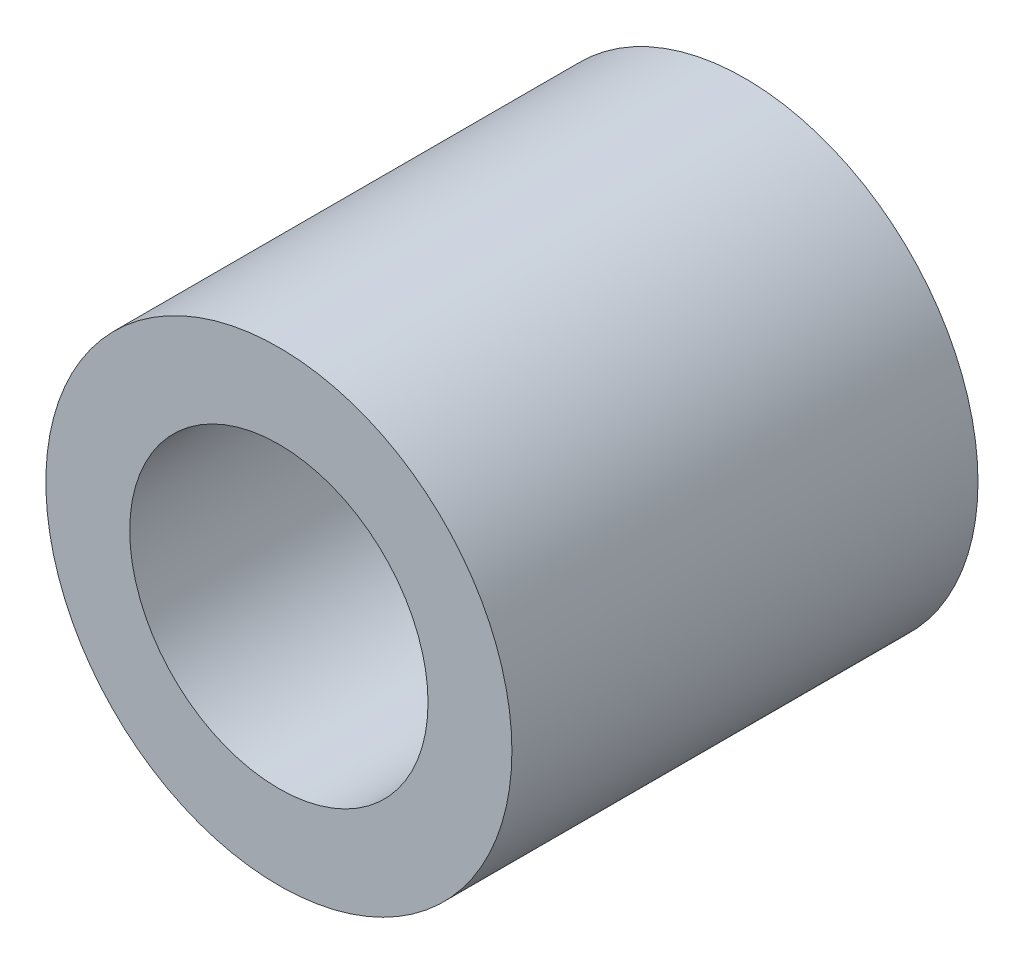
SolidWorks part; units mm, degrees
ref_plane "Alzado" through (0, 0, 0) normal (0, 0, 1) x (1, 0, 0)
ref_plane "Planta" through (0, 0, 0) normal (0, 1, 0) x (1, 0, 0)
ref_plane "Vista lateral" through (0, 0, 0) normal (1, 0, 0) x (0, 0, -1)
sketch "Croquis1" plane through (0, 0, 0) normal (0, 0, 1) x (1, 0, 0)
  circle A0 centre (0, 0) radius 2.5
  circle A1 centre (0, 0) radius 1.6
extrude "Saliente-Extruir1" add sketch "Croquis1" along normal blind 5
